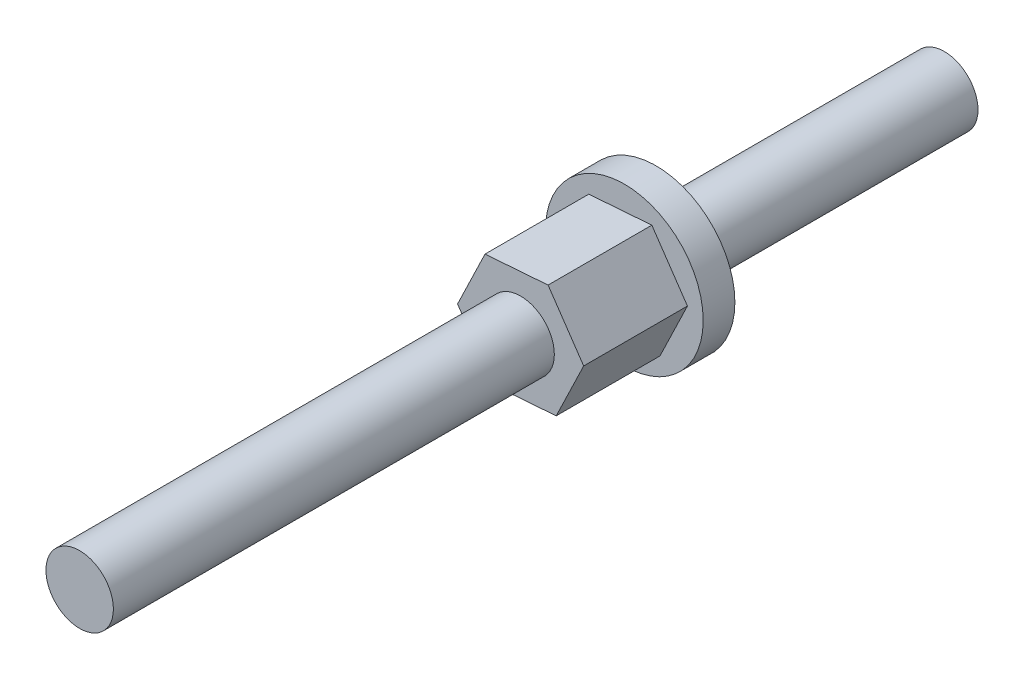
SolidWorks part; units mm, degrees
ref_plane "Front Plane" through (0, 0, 0) normal (0, 0, 1) x (1, 0, 0)
ref_plane "Top Plane" through (0, 0, 0) normal (0, 1, 0) x (1, 0, 0)
ref_plane "Right Plane" through (0, 0, 0) normal (1, 0, 0) x (0, 0, -1)
sketch "Sketch1" plane through (0, 0, 0) normal (0, 0, 1) x (1, 0, 0)
  circle A0 centre (70.1749, 0) radius 2.9718
sketch "Sketch2" plane through (0, 0, 0) normal (0, 0, 1) x (1, 0, 0)
  line L1 (73.3119, -4.6057) -> (75.7321, 0.4139)
  line L2 (75.7321, 0.4139) -> (72.595, 5.0196)
  line L3 (72.595, 5.0196) -> (67.0378, 4.6057)
  line L4 (67.0378, 4.6057) -> (64.6177, -0.4139)
  line L5 (64.6177, -0.4139) -> (67.7547, -5.0196)
  line L6 (67.7547, -5.0196) -> (73.3119, -4.6057)
  circle A0 centre (70.1749, 0) radius 4.826 construction
sketch "Sketch3" plane through (0, 0, 0) normal (0, 0, 1) x (1, 0, 0)
  circle A0 centre (70.1749, 0) radius 6.9469
extrude "Boss-Extrude1" add sketch "Sketch1" along normal blind 50.8 and the other way blind 25.4 contours A0
extrude "Boss-Extrude2" add sketch "Sketch3" along normal blind 2.794 contours A0
extrude "Boss-Extrude3" add sketch "Sketch2" along normal blind 11.938
